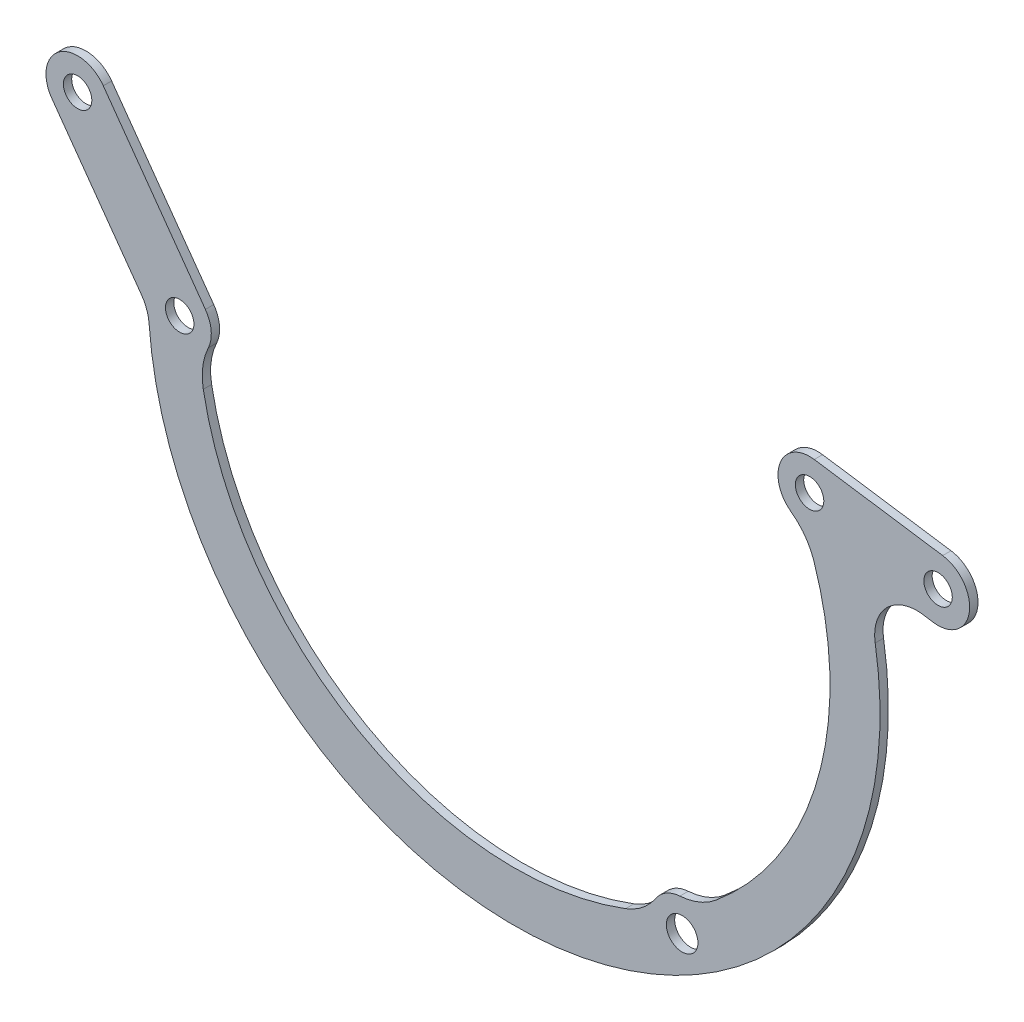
SolidWorks part; units mm, degrees
ref_plane "Front Plane" through (0, 0, 0) normal (0, 0, 1) x (1, 0, 0)
ref_plane "Top Plane" through (0, 0, 0) normal (0, 1, 0) x (1, 0, 0)
ref_plane "Right Plane" through (0, 0, 0) normal (1, 0, 0) x (0, 0, -1)
sketch "Sketch2" plane through (0, 0, 0) normal (0, 0, 1) x (1, 0, 0)
  line L0 (0, 0) -> (-204.25, 0) construction
  line L1 (-204.25, 0) -> (-204.25, -101.25) construction
  line L2 (-204.25, -101.25) -> (-60.75, -101.25) construction
  line L3 (-60.75, -101.25) -> (0, -101.25) construction
  line L4 (0, -101.25) -> (0, 0) construction
  line L5 (0, 0) -> (-60.75, -101.25) construction
  line L6 (-60.75, -101.25) -> (-204.25, 0) construction
  circle A0 centre (0, 0) radius 3.5
  circle A1 centre (-204.25, 0) radius 3.5
  circle A2 centre (-60.75, -101.25) radius 3.5
  dimension "D2" = 7
  dimension "D1" = 204.25
  dimension "D3" = 101.25
  dimension "D4" = 60.75
sketch "Sketch3" plane through (0, 0, 0) normal (0, 0, 1) x (1, 0, 0)
  line L0 (-60.75, -101.25) -> (-30.4968, 4.5079) construction
  line L1 (-30.4968, 4.5079) -> (-180.0123, -33.8502) construction
  line L2 (-180.0123, -33.8502) -> (-60.75, -101.25) construction
  line L3 (0, 0) -> (-60.75, -101.25) construction
  line L4 (-180.0123, -33.8502) -> (-173.6866, -11.7371) construction
  line L5 (-173.6866, -11.7371) -> (-45.6234, -48.371) construction
  circle A0 centre (-60.75, -101.25) radius 3.625
  circle A1 centre (-30.4968, 4.5079) radius 3.625
  circle A2 centre (-180.0123, -33.8502) radius 3.625
  dimension "D1" = 7.25
  dimension "D2" = 110
  dimension "D3" = 23
  dimension "D4" = 133.2
  dimension "D5" = 15
sketch "Sketch5" plane through (0, 0, 0) normal (0, 0, 1) x (1, 0, 0)
  line L0 (-30.4968, 4.5079) -> (0, 0) construction
  line L1 (-29.4001, 11.9273) -> (1.0967, 7.4194)
  line L2 (-31.5935, -2.9114) -> (-1.0967, -7.4194)
  line L3 (-204.25, 0) -> (-180.0123, -33.8502) construction
  line L4 (-198.152, 4.3663) -> (-173.9144, -29.4838)
  line L5 (-210.348, -4.3663) -> (-186.1103, -38.2165)
  arc A0 (-29.4001, 11.9273) -> (-31.5935, -2.9114) centre (-30.4968, 4.5079) ccw
  arc A1 (-1.0967, -7.4194) -> (1.0967, 7.4194) centre (0, 0) ccw
  arc A2 (-198.152, 4.3663) -> (-210.348, -4.3663) centre (-204.25, 0) ccw
  arc A3 (-186.1103, -38.2165) -> (-173.9144, -29.4838) centre (-180.0123, -33.8502) ccw
  circle A4 centre (-60.75, -101.25) radius 7.5
  circle A5 centre (-100.647, -32.6309) radius 86.8747
  circle A6 centre (-30.4968, 4.5079) radius 3.375
  circle A7 centre (0, 0) radius 3.375
  circle A8 centre (-60.75, -101.25) radius 3.375
  circle A9 centre (-180.0123, -33.8502) radius 3.375
  circle A10 centre (-204.25, 0) radius 3.375
  circle A11 centre (-30.4968, 4.5079) radius 7.5
  circle A12 centre (-180.0123, -33.8502) radius 7.5
  circle A13 centre (-100.647, -32.6309) radius 71.8747
  point P2 (-15.2484, 2.254)
  point P9 (-192.1312, -16.9251)
  dimension "D2" = 6.75
  dimension "D3" = 15
  dimension "D4" = 15
  dimension "D1" = 15
extrude "Boss-Extrude2" add sketch "Sketch5" along normal blind 1.9812 contours A13 A4 A5 L2 A11 | A5 L2 A1 L1 A7 | A11 L2 A5 | A11 A0 A6 | A11 A5 L1 | A13 A3 L5 A5 A4 | A4 A8 | A3 A12 A9 | A12 L4 A5 | A5 L4 A2 L5 A10 | A12 A5 L5
fillet "Fillet1" radius 10 2 edges at (-18.3263, -4.8725, 0.9906) (-187.4417, -36.357, 0.9906)
sketch "Sketch6" plane through (0, 0, 1.9812) normal (0, 0, 1) x (1, 0, 0)
  circle A0 centre (-60.75, -101.25) radius 3.75
  dimension "D1" = 7.5
extrude "Cut-Extrude1" cut sketch "Sketch6" against normal through all
sketch "Sketch7" plane through (0, 0, 1.9812) normal (0, 0, 1) x (1, 0, 0)
  arc A0 (-172.5132, -33.735) -> (-37.1252, 0.9987) centre (-100.647, -32.6309) ccw construction
  arc A1 (-172.5132, -33.735) -> (-37.1252, 0.9987) centre (-100.647, -32.6309) ccw
  circle A2 centre (-180.0123, -33.8502) radius 7.5
  circle A3 centre (-30.4968, 4.5079) radius 7.5
  circle A4 centre (-60.75, -101.25) radius 7.5
  circle A5 centre (-100.647, -32.6309) radius 75
  arc A6 (-173.2293, -37.0503) -> (-174.4175, -46.1556) centre (-159.6634, -43.4507) ccw
  arc A7 (-66.9906, -97.09) -> (-74.1779, -102.8049) centre (-79.4717, -88.7701) cw
  arc A8 (-61.278, -93.7686) -> (-52.7558, -90.3496) centre (-62.3341, -78.8058) ccw
  arc A9 (-29.4767, -8.9711) -> (-34.9014, -1.5624) centre (-43.7107, -13.7031) ccw
  dimension "D1" = 150
  dimension "D2" = 15
extrude "Cut-Extrude2" cut sketch "Sketch7" against normal through all contours A7 A4 A1 A2 A6 A5 | A5 A9 A3 A4 A8 M5
